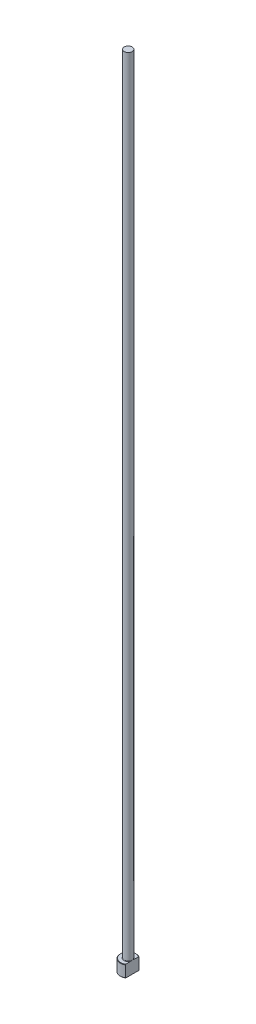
SolidWorks part; units mm, degrees
ref_plane "Front Plane" through (0, 0, 0) normal (0, 0, 1) x (1, 0, 0)
ref_plane "Top Plane" through (0, 0, 0) normal (0, 1, 0) x (1, 0, 0)
ref_plane "Right Plane" through (0, 0, 0) normal (1, 0, 0) x (0, 0, -1)
sketch "Sketch1" plane through (0, 0, 0) normal (0, 0, 1) x (1, 0, 0)
  line L0 (0, 259.9588) -> (0, -15.1925) construction
  line L1 (0, 0) -> (-4, 0)
  line L2 (-4, 0) -> (-4, 6)
  line L3 (-4, 6) -> (-2, 6)
  line L4 (-2, 6) -> (-2, 400)
  line L5 (-2, 400) -> (0, 400)
  line L6 (0, 400) -> (0, 0)
  dimension "L" = 400
  dimension "H" = 8
  dimension "T" = 6
  dimension "D" = 4
revolve "Revolve1" add sketch "Sketch1" angle 360 about L0
chamfer "Chamfer1" distance 0.2 angle 45 2 edges at (0, 6, 4) (0, 0, 4)
fillet "Fillet1" radius 0.2 1 edges at (0, 6, 2)
sketch "Sketch2" plane through (0, 0, 0) normal (0, 1, 0) x (1, 0, 0)
  line L0 (2, -3.4641) -> (2, 3.4641)
  circle A0 centre (0, 0) radius 4 construction
  arc A1 (2, -3.4641) -> (2, 3.4641) centre (0, 0) ccw
  circle A2 centre (0, 0) radius 2 construction
extrude "KEYED HEAD" cut sketch "Sketch2" along normal through all
